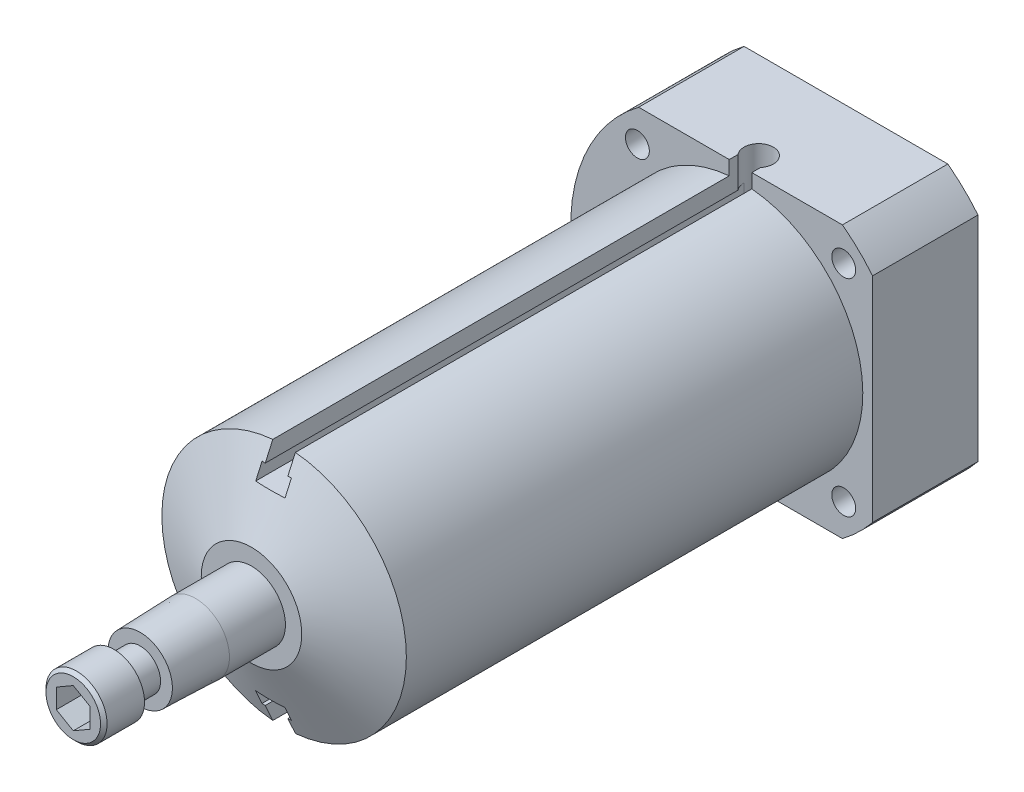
SolidWorks part; units mm, degrees
ref_plane "Front Plane" through (0, 0, 0) normal (0, 0, 1) x (1, 0, 0)
ref_plane "Top Plane" through (0, 0, 0) normal (0, 1, 0) x (1, 0, 0)
ref_plane "Right Plane" through (0, 0, 0) normal (1, 0, 0) x (0, 0, -1)
sketch "Sketch1" plane through (0, 0, 0) normal (0, 0, 1) x (1, 0, 0)
  line L0 (0, 0) -> (62.0084, 0) construction
  line L1 (-23.8125, 31.75) -> (23.8125, 31.75)
  line L2 (30.861, 24.9539) -> (30.861, -24.9539)
  line L3 (-23.8125, -31.75) -> (23.8125, -31.75)
  arc A0 (-23.8125, 31.75) -> (-23.8125, -31.75) centre (0, 0) ccw
  arc A1 (30.861, 24.9539) -> (23.8125, 31.75) centre (0, 0) ccw
  arc A2 (23.8125, -31.75) -> (30.861, -24.9539) centre (0, 0) ccw
  dimension "D1" = 79.375
  dimension "D2" = 63.5
  dimension "D3" = 30.861
extrude "Extrude1" add sketch "Sketch1" along normal blind 138.938
sketch "Sketch2" plane through (0, 0, 0) normal (0, 1, 0) x (1, 0, 0)
  line L0 (0, 0) -> (0, -96.9332) construction
  line L1 (-39.6875, -24.638) -> (-28.575, -24.638)
  line L2 (-39.6875, 0) -> (-39.6875, -138.938) construction
  line L3 (-28.575, -24.638) -> (-28.575, -131.318)
  line L4 (-28.575, -131.318) -> (-11.7475, -138.938)
  line L7 (-11.7475, -138.938) -> (-39.6875, -138.938)
  line L8 (-39.6875, -138.938) -> (-39.6875, -24.638)
  dimension "D1" = 114.3
  dimension "D2" = 57.15
  dimension "D3" = 23.495
  dimension "D4" = 7.62
revolve "Cut-Revolve1" cut sketch "Sketch2" angle 360 about L0
sketch "Sketch4" plane through (0, 0, 0) normal (0, 1, 0) x (1, 0, 0)
  line L0 (0, 0) -> (0, -99.9671) construction
  line L1 (-7.9311, -138.938) -> (-7.9311, -152.019)
  line L2 (-11.7475, -138.938) -> (11.7475, -138.938) construction
  line L3 (-7.9311, -152.019) -> (-7.5247, -164.9509)
  line L4 (-7.5247, -164.9509) -> (0, -164.9509)
  line L7 (0, -164.9509) -> (0, -138.938)
  line L8 (0, -138.938) -> (-7.9311, -138.938)
  line L10 (-23.8125, 0) -> (-39.6875, 0) construction
  dimension "D1" = 1.8
  dimension "D4" = 15.8623
  dimension "D5" = 15.0495
  dimension "D6" = 12.9319
  dimension "D7" = 152.019
revolve "Revolve1" add sketch "Sketch4" angle 360 about L0
hole_wizard "Hole1" positions "Sketch6" profile "Sketch5" legacy
sketch "Sketch6" plane through (0, 0, 164.9509) normal (0, 0, 1) x (1, 0, 0)
  circle A0 centre (0, 0) radius 7.5247 construction
  point P0 (0, 0)
sketch "Sketch5" plane through (0, 0, 164.9509) normal (1, 0, 0) x (0, -1, 0)
  line L0 (0, 0) -> (0, 21.5835)
  line L1 (0, 21.5835) -> (4.2164, 19.05)
  line L2 (4.2164, 19.05) -> (4.2164, 0)
  line L4 (4.2164, 0) -> (0, 0)
  line L6 (0, 21.5835) -> (-4.2164, 19.05) construction
  line L7 (0, -4.2442) -> (0, 117.3081) construction
  dimension "Diameter" = 8.4328
  dimension "Depth" = 19.05
  dimension "Drill Angle" = 118
hole_wizard "Hole2" positions "Sketch10" profile "Sketch9" legacy
sketch "Sketch10" plane through (0, 0, 24.638) normal (0, 0, 1) x (1, 0, 0)
  line L1 (0, 0) -> (19.5659, 0) construction
  line L2 (0, 0) -> (24.112, 24.112) construction
  circle A0 centre (0, 0) radius 34.0995 construction
  point P0 (24.112, 24.112)
  dimension "D2" = 68.199
  dimension "D1" = 45
sketch "Sketch9" plane through (24.112, 24.112, 24.638) normal (1, 0, 0) x (0, -1, 0)
  line L0 (0, 0) -> (0, 24.639)
  line L1 (0, 24.639) -> (2.794, 24.639)
  line L2 (2.794, 24.639) -> (2.794, 0)
  line L3 (2.794, 0) -> (0, 0)
  line L4 (0, 110) -> (0, -10) construction
  dimension "Diameter" = 5.588
  dimension "Depth" = 24.639
pattern_circular "CirPattern1" count 4 over 360 about axis through (0, 0, 0) along (0, 0, 1) of "Hole2"
ref_plane "Plane1" through (0, 0, 15.7988) normal (0, 0, -1) x (-1, 0, 0)
sketch "Sketch11" plane through (0, 0, 15.7988) normal (0, 0, -1) x (-1, 0, 0)
  line L0 (0, 0) -> (24.6663, 11.5021) construction
  line L1 (0, 0) -> (27.0444, 0) construction
  line L2 (69.89, 37.1865) -> (23.8495, 15.7175)
  line L3 (23.8495, 15.7175) -> (25.61, 11.9421)
  line L4 (25.61, 11.9421) -> (71.6504, 33.4111)
  line L5 (71.6504, 33.4111) -> (69.89, 37.1865)
  dimension "D1" = 25
  dimension "D2" = 28.2575
  dimension "D3" = 8.3312
  dimension "D4" = 50.8
revolve "Cut-Revolve2" cut sketch "Sketch11" angle 360 about L0
mirror "Mirror1" about plane through (0, 0, 0) normal (0, 1, 0) of "Cut-Revolve2"
sketch "Sketch12" plane through (0, 0, 138.938) normal (0, 0, 1) x (1, 0, 0)
  line L0 (0, 0) -> (0, 26.7352) construction
  line L1 (-2.6416, 50.8) -> (-2.6416, 24.5237)
  line L2 (-2.6416, 24.5237) -> (-3.429, 24.5237)
  line L3 (-3.429, 24.5237) -> (-3.429, 21.2217)
  line L4 (-3.429, 21.2217) -> (3.429, 21.2217)
  line L5 (3.429, 24.5237) -> (3.429, 21.2217)
  line L6 (2.6416, 24.5237) -> (3.429, 24.5237)
  line L7 (2.6416, 50.8) -> (2.6416, 24.5237)
  line L8 (-2.6416, 50.8) -> (2.6416, 50.8)
  dimension "D1" = 5.2832
  dimension "D2" = 6.858
  dimension "D3" = 3.302
  dimension "D4" = 21.2217
  dimension "D5" = 50.8
extrude "Cut-Extrude1" cut sketch "Sketch12" against normal blind 118.5418
sketch "Sketch13" plane through (0, 0, 138.938) normal (0, 0, 1) x (1, 0, 0)
  line L0 (0, 0) -> (32.0428, 0) construction
  line L1 (0, 0) -> (0, -27.5102) construction
  line L2 (-3.429, -21.2217) -> (3.429, -21.2217)
  line L3 (3.429, -21.2217) -> (3.429, -24.5237)
  line L4 (3.429, -24.5237) -> (2.6416, -24.5237)
  line L5 (2.6416, -24.5237) -> (2.6416, -50.8)
  line L6 (2.6416, -50.8) -> (-2.6416, -50.8)
  line L7 (-3.429, 21.2217) -> (3.429, 21.2217) construction
  line L8 (3.429, 24.5237) -> (3.429, 21.2217) construction
  line L9 (2.6416, 50.8) -> (2.6416, 24.5237) construction
  line L10 (-2.6416, -24.5237) -> (-2.6416, -50.8)
  line L11 (-3.429, -24.5237) -> (-2.6416, -24.5237)
  line L12 (-3.429, -21.2217) -> (-3.429, -24.5237)
extrude "Cut-Extrude2" cut sketch "Sketch13" against normal blind 98.425
sketch "Sketch14" plane through (0, 31.75, 0) normal (0, 1, 0) x (1, 0, 0)
  line L0 (-2.6416, -20.3962) -> (2.6416, -20.3962) construction
  circle A0 centre (0, -20.3962) radius 3.429
  dimension "D1" = 3.429
extrude "Cut-Extrude3" cut sketch "Sketch14" against normal up to surface (10.5283 mm away)
sketch "Sketch15" plane through (0, -31.75, 0) normal (0, -1, 0) x (1, 0, 0)
  line L0 (3.429, 40.513) -> (-3.429, 40.513) construction
  circle A0 centre (0, 40.513) radius 3.429
  dimension "D1" = 3.429
extrude "Cut-Extrude4" cut sketch "Sketch15" against normal up to surface (10.5283 mm away)
sketch "Sketch16" plane through (0, 0, 0) normal (0, 1, 0) x (1, 0, 0)
  line L0 (0, 0) -> (0, -122.9241) construction
  line L1 (-4.7625, -164.9509) -> (-4.7625, -171.069)
  line L2 (-7.5247, -164.9509) -> (7.5247, -164.9509) construction
  line L3 (-4.7625, -171.069) -> (-7.1374, -171.069)
  line L4 (-7.1374, -171.069) -> (-7.1374, -179.832)
  line L5 (-7.1374, -179.832) -> (-6.3754, -180.594)
  line L6 (-6.3754, -180.594) -> (0, -180.594)
  line L7 (0, -180.594) -> (0, -164.9509)
  line L8 (0, -164.9509) -> (-4.7625, -164.9509)
  line L9 (-7.9311, -152.019) -> (7.9311, -152.019) construction
  dimension "D1" = 9.525
  dimension "D2" = 19.05
  dimension "D3" = 14.2748
  dimension "D4" = 9.525
  dimension "D5" = 45
  dimension "D6" = 12.7508
revolve "Revolve2" add sketch "Sketch16" angle 360 about L0
sketch "Sketch17" plane through (0, 0, 180.594) normal (0, 0, 1) x (1, 0, 0)
  line L1 (3.9624, -2.2877) -> (3.9624, 2.2877)
  line L2 (3.9624, 2.2877) -> (0, 4.5754)
  line L3 (0, 4.5754) -> (-3.9624, 2.2877)
  line L4 (-3.9624, 2.2877) -> (-3.9624, -2.2877)
  line L5 (-3.9624, -2.2877) -> (0, -4.5754)
  line L6 (0, -4.5754) -> (3.9624, -2.2877)
  circle A0 centre (0, 0) radius 3.9624 construction
  dimension "D1" = 7.9248
extrude "Cut-Extrude5" cut sketch "Sketch17" against normal blind 6.35
